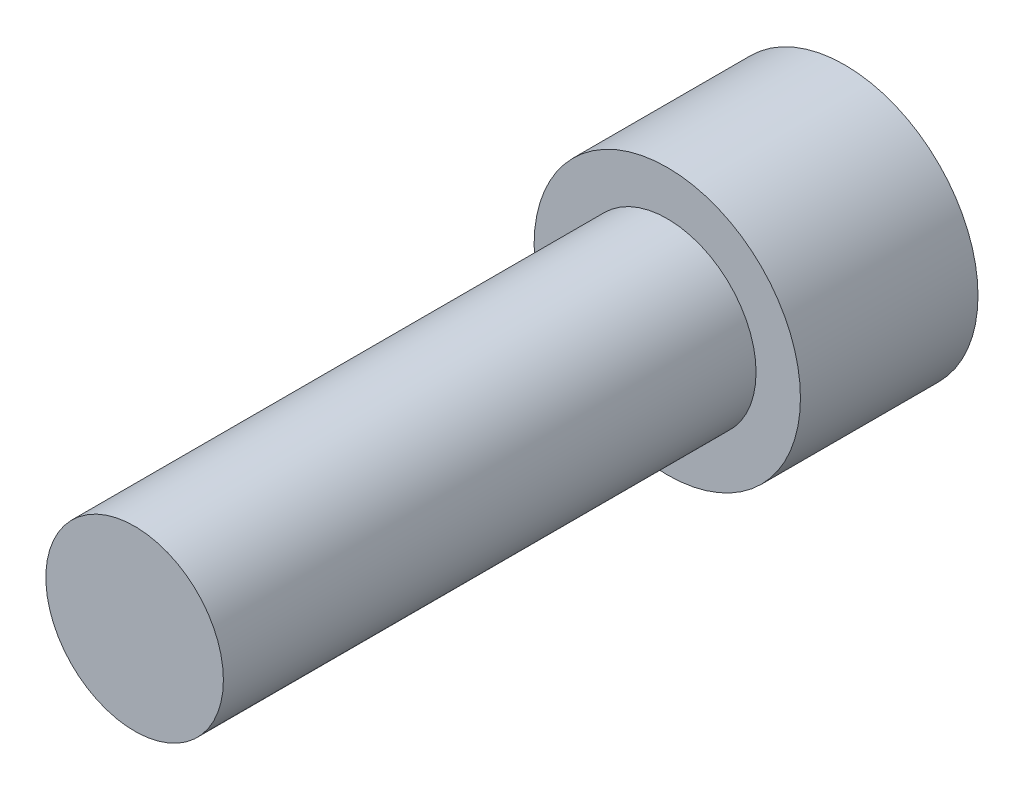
SolidWorks part; units mm, degrees
ref_plane "Front Plane" through (0, 0, 0) normal (0, 0, 1) x (1, 0, 0)
ref_plane "Top Plane" through (0, 0, 0) normal (0, 1, 0) x (1, 0, 0)
ref_plane "Right Plane" through (0, 0, 0) normal (1, 0, 0) x (0, 0, -1)
sketch "Sketch6" plane through (0, 0, 0) normal (1, 0, 0) x (0, 0, -1)
  line L0 (-19.05, 0) -> (22.525, 0) construction
  line L1 (5.2388, 0) -> (-5.2388, 0) construction
  line L2 (-19.05, 0) -> (-19.05, -3.175)
  line L3 (-19.05, -3.175) -> (0, -3.175)
  line L4 (0, 5.2388) -> (0, -5.2388) construction
  line L5 (0, -3.175) -> (0, -4.7625)
  line L6 (0, -4.7625) -> (6.35, -4.7625)
  line L7 (6.35, -4.7625) -> (6.35, 0)
  line L8 (6.35, 0) -> (-19.05, 0)
  dimension "L" = 19.05
  dimension "H" = 6.35
  dimension "A" = 9.525
  dimension "D" = 6.35
revolve "Revolve1" add sketch "Sketch6" angle 360 about L0
sketch "Sketch7" plane through (0, 0, -6.35) normal (0, 0, -1) x (-1, 0, 0)
  line L2 (-2.3876, 1.3785) -> (-2.3876, -1.3785)
  line L4 (-2.3876, -1.3785) -> (0, -2.757)
  line L5 (0, -2.757) -> (2.3876, -1.3785)
  line L6 (2.3876, -1.3785) -> (2.3876, 1.3785)
  line L7 (2.3876, 1.3785) -> (0, 2.757)
  line L8 (0, 2.757) -> (-2.3876, 1.3785)
  circle A0 centre (0, 0) radius 2.3876 construction
  dimension "J" = 4.7752
extrude "HEX" cut sketch "Sketch7" against normal blind 3.556
